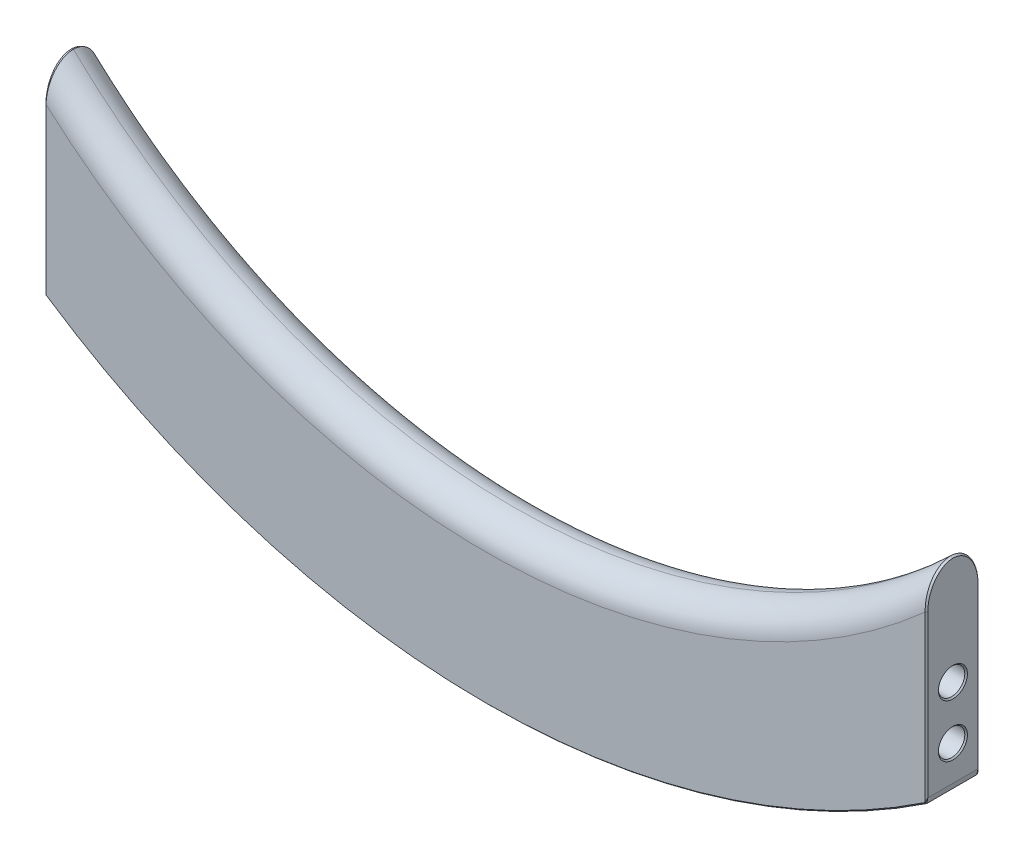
SolidWorks part; units mm, degrees
ref_plane "Спереди" through (0, 0, 0) normal (0, 0, 1) x (1, 0, 0)
ref_plane "Сверху" through (0, 0, 0) normal (0, 1, 0) x (1, 0, 0)
ref_plane "Справа" through (0, 0, 0) normal (1, 0, 0) x (0, 0, -1)
sketch "Эскиз1" plane through (0, 0, 0) normal (0, 0, 1) x (1, 0, 0)
  line L0 (0, 0) -> (0, -300) construction
  line L1 (-167, -172.3688) -> (-167, -249.2208)
  line L2 (167, -172.3688) -> (167, -249.2208)
  arc A0 (-167, -172.3688) -> (167, -172.3688) centre (0, 0) ccw
  arc A1 (-167, -249.2208) -> (167, -249.2208) centre (0, 0) ccw
  dimension "D1" = 480
  dimension "D2" = 600
  dimension "D3" = 334
extrude "Бобышка-Вытянуть1" add sketch "Эскиз1" along normal mid plane 20
fillet "Скругление1" radius 10 2 edges at (0, -240, -10) (0, -240, 10)
sketch "Эскиз2" plane through (167, 0, 0) normal (1, 0, 0) x (0, 0, -1)
  line L0 (-10, -249.2208) -> (10, -249.2208) construction
  circle A0 centre (0, -214.2208) radius 5
  circle A1 centre (0, -234.2208) radius 5
  dimension "D3" = 10
  dimension "D1" = 15
  dimension "D2" = 20
extrude "Вырез-Вытянуть1" cut sketch "Эскиз2" against normal blind 25
mirror "Зеркальное отражение1" about plane through (0, 0, 0) normal (1, 0, 0) of "Вырез-Вытянуть1"
chamfer "Фаска1" distance 0.5 angle 45 20 edges at (-167, -229.2208, 0) (-142, -229.2208, 0) (-167, -209.2208, 0) (-142, -209.2208, 0) (167, -229.2208, 0) (142, -229.2208, 0) (167, -209.2208, 0) (142, -209.2208, 0) (167, -249.2208, 0) (-167, -249.2208, 0) (0, -300, -10) (-167, -217.6306, -10) (-167, -174.2084, -4.9737) (-167, -176.6248, 7.2139) (-167, -217.6306, 10) (0, -300, 10) (167, -217.6306, -10) (167, -176.6248, -7.2139) (167, -174.2084, 4.9737) (167, -217.6306, 10)
